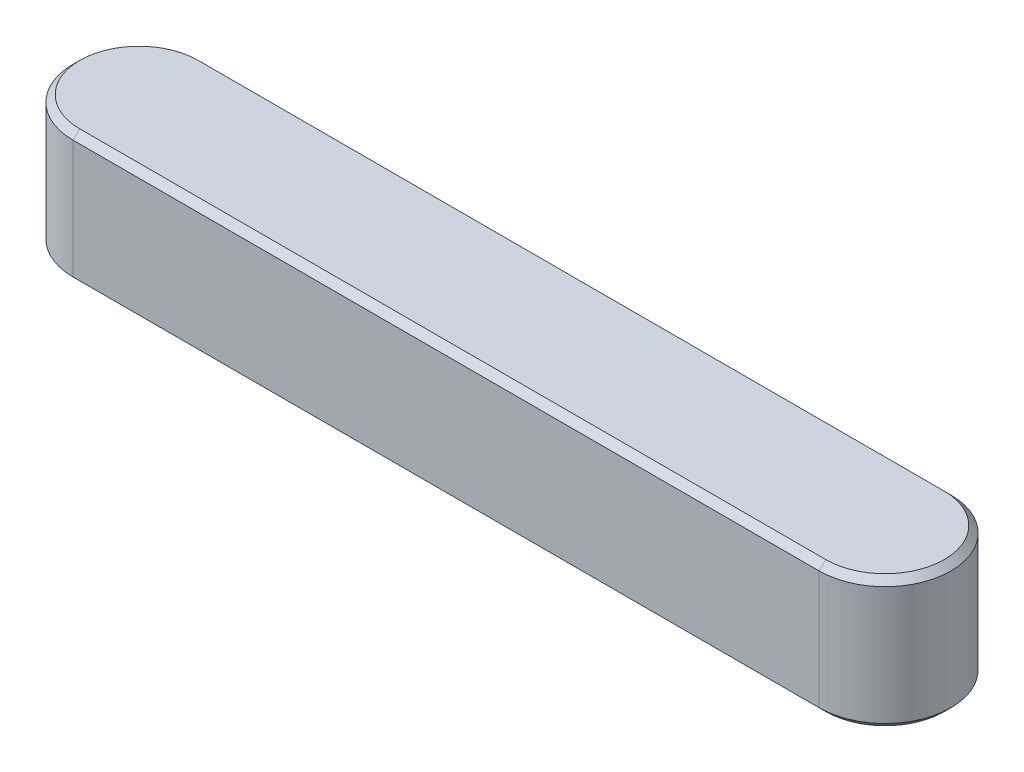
SolidWorks part; units mm, degrees
ref_plane "Front Plane" through (0, 0, 0) normal (0, 0, 1) x (1, 0, 0)
ref_plane "Top Plane" through (0, 0, 0) normal (0, 1, 0) x (1, 0, 0)
ref_plane "Right Plane" through (0, 0, 0) normal (1, 0, 0) x (0, 0, -1)
sketch "Sketch1" plane through (0, 0, 0) normal (0, 1, 0) x (1, 0, 0)
  line L0 (-8.5, 0) -> (8.5, 0) construction
  line L1 (-8.5, 1.5) -> (8.5, 1.5)
  line L2 (-8.5, -1.5) -> (8.5, -1.5)
  arc A0 (-8.5, 1.5) -> (-8.5, -1.5) centre (-8.5, 0) ccw
  arc A1 (8.5, -1.5) -> (8.5, 1.5) centre (8.5, 0) ccw
  point P3 (0, 0)
  point P8 (0, -1.5)
  dimension "D2" = 1.5
  dimension "D1" = 17
extrude "Boss-Extrude1" add sketch "Sketch1" along normal blind 3
chamfer "Chamfer1" distance 0.15 angle 45 8 edges at (0, 0, 1.5) (10, 0, 0) (0, 0, -1.5) (-10, 0, 0) (0, 3, -1.5) (10, 3, 0) (0, 3, 1.5) (-10, 3, 0)
